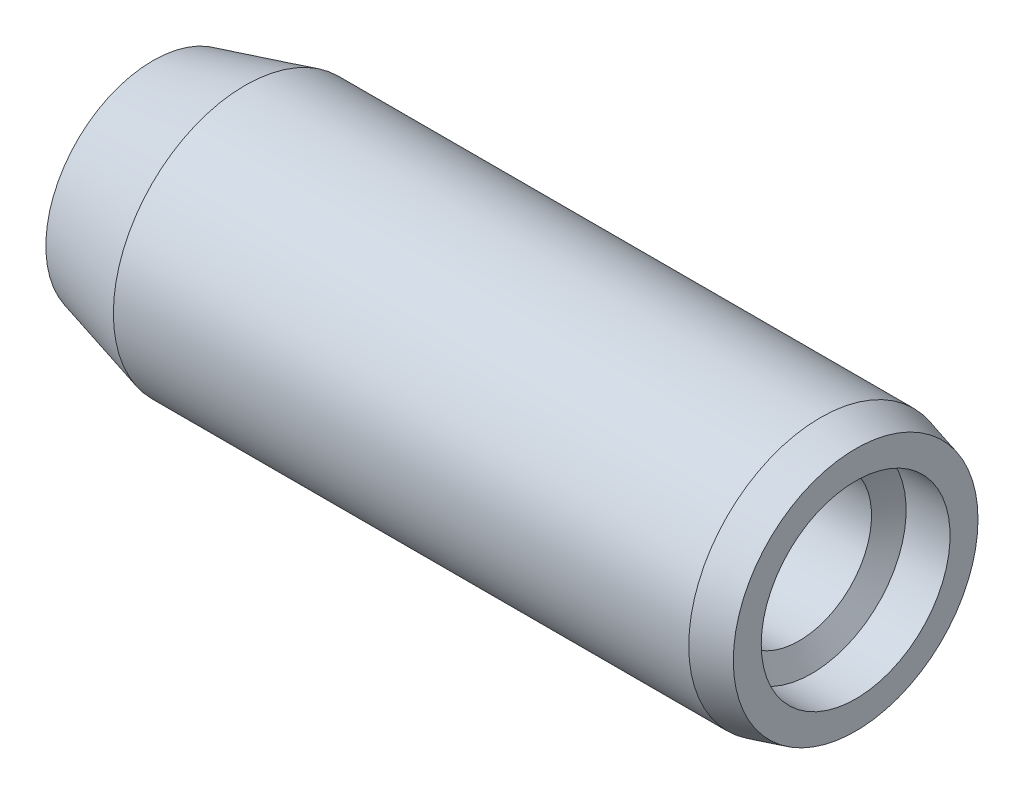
SolidWorks part; units mm, degrees
ref_plane "Front" through (0, 0, 0) normal (0, 0, 1) x (1, 0, 0)
ref_plane "Top" through (0, 0, 0) normal (0, 1, 0) x (1, 0, 0)
ref_plane "Right" through (0, 0, 0) normal (1, 0, 0) x (0, 0, -1)
sketch "Sketch1" plane through (0, 0, 0) normal (0, 0, 1) x (1, 0, 0)
  line L0 (0.5904, 2.5955) -> (0.5904, 0) construction
  line L1 (-3.8625, 0) -> (2.9703, 0) construction
  line L3 (0.5904, 2.5955) -> (2.1, 3)
  line L4 (2.1, 3) -> (15.2, 3)
  line L5 (15.2, 3) -> (16, 2.7856)
  line L6 (16, 2.7856) -> (16, 0)
  line L7 (16, 0) -> (0, 0)
  arc A0 (0.5904, 2.5955) -> (0, 0) centre (6, 0) ccw
  dimension "D1" = 6
  dimension "d" = 6
  dimension "D3" = 15
  dimension "l" = 16
  dimension "a" = 0.8
  dimension "D7" = 75
  dimension "c" = 2.1
revolve "Base-Revolve" add sketch "Sketch1" angle 360 about L1
sketch "Sketch2" plane through (0, 0, 0) normal (0, 0, 1) x (1, 0, 0)
  line L0 (0, 0) -> (0, 2.4373)
  line L1 (0, 2.4373) -> (2.1, 3)
  line L2 (2.1, 3) -> (15.2, 3)
  line L3 (15.2, 3) -> (16, 2.7856)
  line L4 (16, 2.7856) -> (16, 0)
  line L5 (16, 0) -> (0, 0)
  line L6 (0, 0) -> (-16.9805, 0) construction
  dimension "D1" = 6
  dimension "D2" = 15
  dimension "D3" = 75
  dimension "D4" = 16
  dimension "D5" = 0.8
  dimension "D6" = 2.1
revolve "Base-Revolve2" add sketch "Sketch2" angle 360 about L6
sketch "Sketch3" plane through (0, 0, 0) normal (0, 0, 1) x (1, 0, 0)
  line L0 (16, 0) -> (16, 2.15) construction
  line L1 (16, 2.15) -> (16.2, 2.15)
  line L2 (16, 2.15) -> (15, 2.15)
  line L3 (15, 2.15) -> (14.7113, 1.65)
  line L4 (14.7113, 1.65) -> (6, 1.65)
  line L5 (6, 1.65) -> (5.0474, 0)
  line L6 (5.0474, 0) -> (16, 0)
  line L7 (16, 0) -> (16.7399, 0) construction
  line L8 (16.2, 2.15) -> (16.2, 0)
  line L9 (16, -2.7856) -> (16, 2.7856) construction
  line L10 (16.2, 0) -> (16, 0)
  dimension "D1" = 0.2
  dimension "d2" = 4.3
  dimension "d0" = 3.3
  dimension "t3" = 1
  dimension "D4" = 60
  dimension "D5" = 60
  dimension "t2" = 10
revolve "TypeA" cut sketch "Sketch3" angle 360 about L7
sketch "Sketch4" plane through (0, 0, 0) normal (0, 0, 1) x (1, 0, 0)
  line L0 (0, 0) -> (22.7307, 0) construction
  line L1 (9.825, -1.3) -> (10.175, -1.3)
  line L2 (10.175, -1.3) -> (10.175, -1.65)
  line L3 (10.175, -1.65) -> (10, -1.9531)
  line L4 (10, -1.9531) -> (9.825, -1.65)
  line L5 (9.825, -1.3) -> (9.825, -1.65)
  line L6 (16, -2.15) -> (16, 2.15) construction
  dimension "D1" = 3.3
  dimension "D2" = 6
  dimension "D3" = 0.35
revolve "Cut-Revolve10" [suppressed] cut sketch "Sketch4" angle 360 about L0
pattern_linear "LPattern10" [suppressed] count 14 spacing 0.42 along (1, 0, 0)
equation "\"D1@Sketch1\" = \"d@Sketch1\""
equation "\"D6@Sketch2\" = \"c@Sketch1\""
equation "\"D4@Sketch2\" = \"l@Sketch1\""
equation "\"D1@Sketch2\" = \"d@Sketch1\""
equation "\"D5@Sketch2\" = \"a@Sketch1\""
equation "\"D1@Sketch4\" = \"d0@Sketch3\""
equation "\"D2@Sketch4\" = \"t1@ThreadCosmetic1\""
equation "\"D3@Sketch4\" = (  \"d1@ThreadCosmetic1\" - \"d0@Sketch3\" )  / 2"
equation "\"D3@LPattern10\" = \"D3@Sketch4\"*1.2"
equation "\"D1@LPattern10\" = \"t1@ThreadCosmetic1\" / \"D3@LPattern10\""
